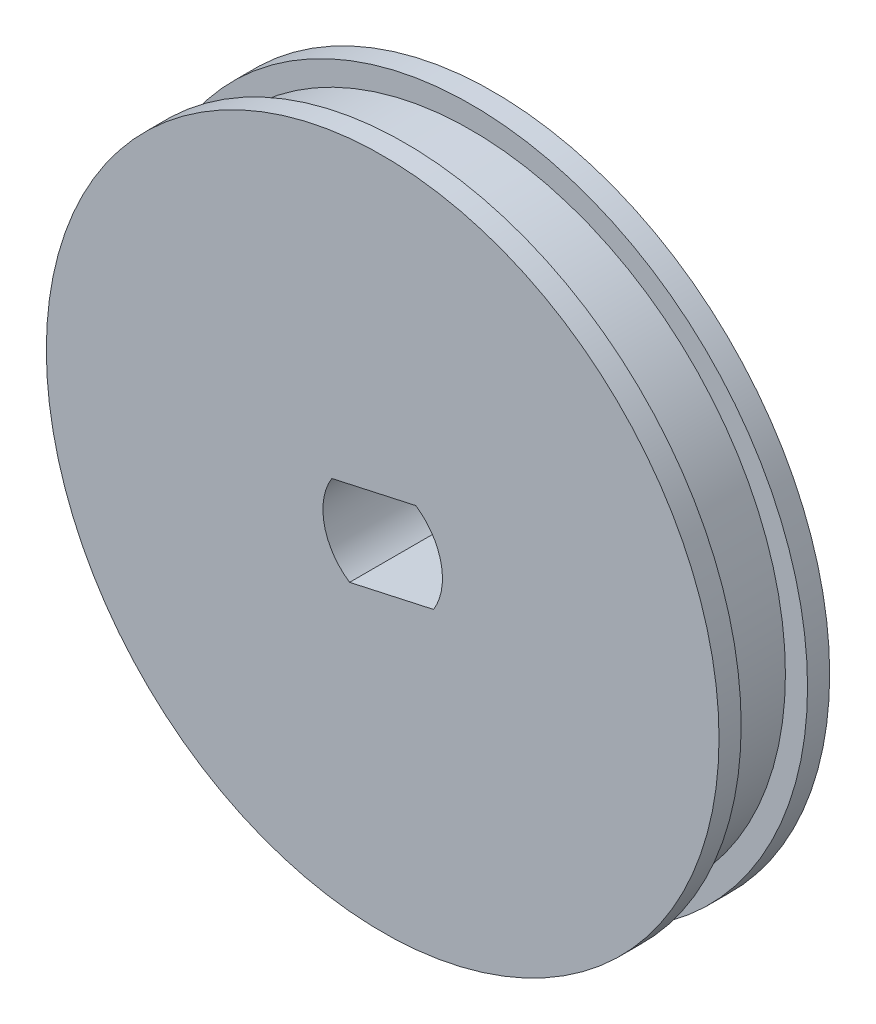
SolidWorks part; units mm, degrees
ref_plane "前视基准面" through (0, 0, 0) normal (0, 0, 1) x (1, 0, 0)
ref_plane "上视基准面" through (0, 0, 0) normal (0, 1, 0) x (1, 0, 0)
ref_plane "右视基准面" through (0, 0, 0) normal (1, 0, 0) x (0, 0, -1)
sketch "草图1" plane through (0, 0, 0) normal (0, 0, 1) x (1, 0, 0)
  line L1 (3.4308, 6.482) -> (1.9255, 13.3182) construction
  circle A0 centre (22.4165, -13.7077) radius 14.2
extrude "凸台-拉伸1" add sketch "草图1" along normal mid plane 3
sketch "草图2" plane through (0, 0, 1.5) normal (0, 0, 1) x (1, 0, 0)
  circle A2 centre (22.4165, -13.7077) radius 15.2
  circle A3 centre (22.4165, -13.7077) radius 15.2
  dimension "D1" = 1
extrude "凸台-拉伸2" add sketch "草图2" along normal blind 1
mirror "镜向1" about plane through (0, 0, 0) normal (0, 0, 1) of "凸台-拉伸2"
sketch "草图3" plane through (0, 0, 2.5) normal (0, 0, 1) x (1, 0, 0)
  line L0 (23.9107, -11.4588) -> (20.116, -12.2943) construction
  line L1 (20.9224, -15.9566) -> (24.7171, -15.121) construction
  line L2 (23.9107, -11.4588) -> (20.116, -12.2943)
  line L3 (20.9224, -15.9566) -> (24.7171, -15.121)
  arc A0 (20.116, -12.2943) -> (20.9224, -15.9566) centre (22.4165, -13.7077) ccw construction
  arc A1 (24.7171, -15.121) -> (23.9107, -11.4588) centre (22.4165, -13.7077) ccw construction
  arc A3 (20.116, -12.2943) -> (20.9224, -15.9566) centre (22.4165, -13.7077) ccw
  arc A4 (24.7171, -15.121) -> (23.9107, -11.4588) centre (22.4165, -13.7077) ccw
extrude "切除-拉伸1" cut sketch "草图3" against normal through all
